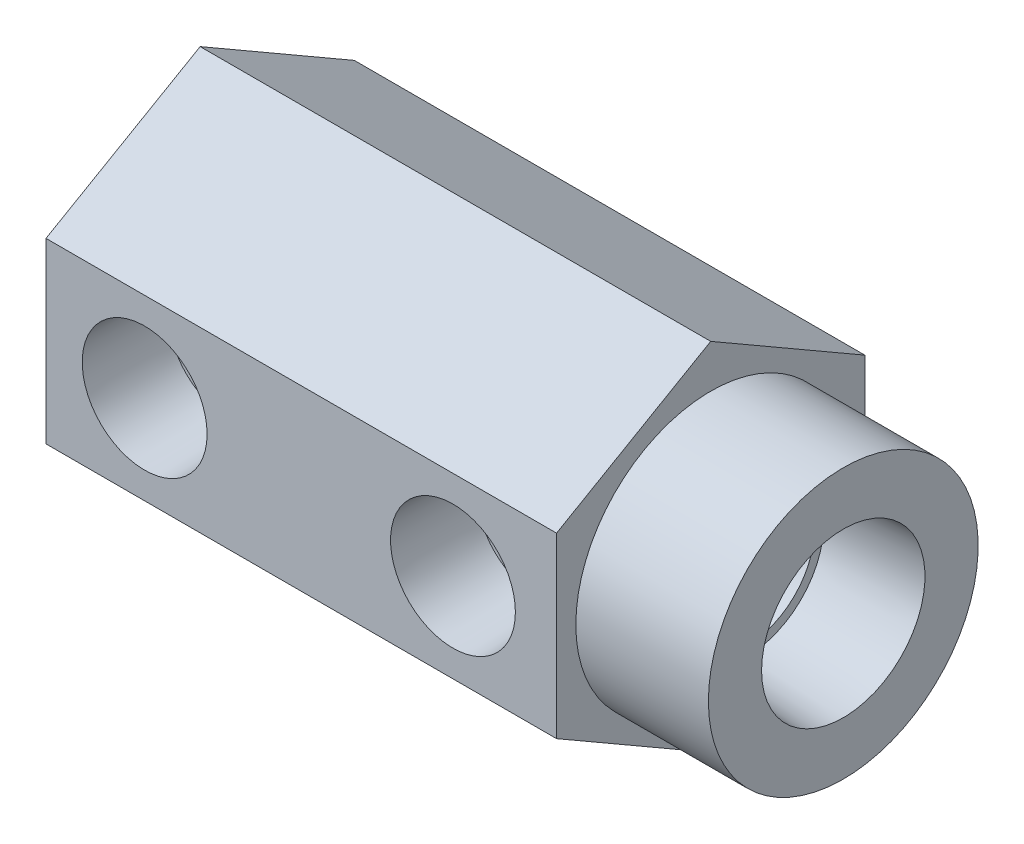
SolidWorks part; units mm, degrees
ref_plane "Front Plane" through (0, 0, 0) normal (0, 0, 1) x (1, 0, 0)
ref_plane "Top Plane" through (0, 0, 0) normal (0, 1, 0) x (1, 0, 0)
ref_plane "Right Plane" through (0, 0, 0) normal (1, 0, 0) x (0, 0, -1)
sketch "Sketch1" plane through (0, 0, 0) normal (1, 0, 0) x (0, 0, -1)
  line L0 (0, 16.1312) -> (0, -16.1312) construction
  line L1 (0, -14.6647) -> (12.7, -7.3323)
  line L2 (12.7, -7.3323) -> (12.7, 7.3323)
  line L3 (12.7, 7.3323) -> (0, 14.6647)
  line L4 (0, 14.6647) -> (-12.7, 7.3323)
  line L5 (-12.7, 7.3323) -> (-12.7, -7.3323)
  line L6 (-12.7, -7.3323) -> (0, -14.6647)
  circle A0 centre (0, 0) radius 12.7 construction
  dimension "D1" = 25.4
extrude "Boss-Extrude1" add sketch "Sketch1" along normal blind 42.0624 separate body
sketch "Sketch2" plane through (0, 0, 0) normal (1, 0, 0) x (0, 0, -1)
  circle A1 centre (0, 0) radius 11.1125
  dimension "D1" = 22.225
extrude "Boss-Extrude2" add sketch "Sketch2" along normal blind 52.9844
hole_wizard "5/16-24 Tapped Hole1" positions "Sketch4" profile "Sketch3" tap size "5/16-24" standard "ANSI Inch"
sketch "Sketch4" plane through (52.9844, 0, 0) normal (1, 0, 0) x (0, 0, -1)
  point P0 (0, 0)
sketch "Sketch3" plane through (52.9844, 0, 0) normal (0, 1, 0) x (0, 0, -1)
  line L0 (0, 0) -> (0, 43.3532)
  line L1 (0, 43.3532) -> (3.4544, 41.2775)
  line L2 (3.4544, 41.2775) -> (3.4544, 36.576)
  line L3 (3.4544, 36.576) -> (3.9687, 36.576)
  line L4 (3.9687, 36.576) -> (3.9688, 0)
  line L5 (3.9688, 0) -> (0, 0)
  line L10 (0, 43.3532) -> (-3.4544, 41.2775) construction
  line L11 (0, -6.35) -> (0, 107.95) construction
  dimension "Tap Drill Dia." = 6.9088
  dimension "Tap Drill Depth" = 41.2775
  dimension "Thread Major Dia." = 7.9375
  dimension "Thread Depth" = 36.576
  dimension "Drill Angle" = 118
hole_wizard "7/32 (0.21875) Diameter Hole1" positions "Sketch6" profile "Sketch5" hole size "7/32" standard "Ansi Inch"
sketch "Sketch6" plane through (52.9844, 0, 0) normal (1, 0, 0) x (0, 0, -1)
  point P0 (0, 0)
sketch "Sketch5" plane through (52.9844, 0, 0) normal (0, 1, 0) x (0, 0, -1)
  line L0 (0, 0) -> (0, 46.1193)
  line L1 (0, 46.1193) -> (2.7781, 44.45)
  line L2 (2.7781, 44.45) -> (2.7781, 0)
  line L5 (2.7781, 0) -> (0, 0)
  line L10 (0, 46.1193) -> (-2.7781, 44.45) construction
  line L11 (0, -6.35) -> (0, 107.95) construction
  dimension "Hole Dia." = 5.5562
  dimension "Hole Depth" = 44.45
  dimension "Drill Angle" = 118
hole_wizard "1/8 NPT Tapped Hole1" positions "Sketch8" profile "Sketch7" size "1/8" standard "Ansi Inch"
sketch "Sketch8" plane through (0, 0, 12.7) normal (0, 0, 1) x (1, 0, 0)
  line L0 (13.97, 0) -> (-13.97, 0) construction
  line L1 (0, -13.97) -> (0, 13.97) construction
  point P0 (8.128, 0)
  point P1 (33.528, 0)
  dimension "D1" = 8.128
  dimension "D2" = 25.4
sketch "Sketch7" plane through (8.128, 0, 12.7) normal (1, 0, 0) x (0, -1, 0)
  line L0 (0, 0) -> (0, 21.5835)
  line L1 (4.2164, 19.05) -> (0, 21.5835)
  line L2 (-4.2164, 19.05) -> (0, 21.5835) construction
  line L3 (4.2164, 19.05) -> (4.2164, 6.924)
  line L4 (4.2164, 6.924) -> (4.9362, 6.924)
  line L5 (4.9362, 6.924) -> (5.1435, 0)
  line L6 (-4.9362, 6.924) -> (-5.1435, 0) construction
  line L7 (5.1435, 0) -> (0, 0)
  line L8 (0, -6.35) -> (0, 107.95) construction
  line L11 (-4.2164, 6.924) -> (-4.9362, 6.924) construction
  dimension "Tap Drill Dia." = 8.4328
  dimension "Tap Drill Depth" = 19.05
  dimension "Thread Dia." = 10.287
  dimension "Thread Angle" = 3.43
  dimension "Thread Depth" = 6.924
  dimension "Drill Angle" = 118
hole_wizard "1/8 NPT Tapped Hole2" positions "Sketch10" profile "Sketch9" size "1/8" standard "Ansi Inch"
sketch "Sketch10" plane through (0, 0, -12.7) normal (0, 0, -1) x (-1, 0, 0)
  line L0 (13.97, 0) -> (-13.97, 0) construction
  line L1 (0, 13.97) -> (0, -13.97) construction
  point P0 (-8.128, 0)
  dimension "D1" = 8.128
sketch "Sketch9" plane through (8.128, 0, -12.7) normal (1, 0, 0) x (0, 1, 0)
  line L0 (0, 0) -> (0, 18.4085)
  line L1 (4.2164, 15.875) -> (0, 18.4085)
  line L2 (-4.2164, 15.875) -> (0, 18.4085) construction
  line L3 (4.2164, 15.875) -> (4.2164, 6.924)
  line L4 (4.2164, 6.924) -> (4.9362, 6.924)
  line L5 (4.9362, 6.924) -> (5.1435, 0)
  line L6 (-4.9362, 6.924) -> (-5.1435, 0) construction
  line L7 (5.1435, 0) -> (0, 0)
  line L8 (0, -6.35) -> (0, 107.95) construction
  line L11 (-4.2164, 6.924) -> (-4.9362, 6.924) construction
  dimension "Tap Drill Dia." = 8.4328
  dimension "Tap Drill Depth" = 15.875
  dimension "Thread Dia." = 10.287
  dimension "Thread Angle" = 3.43
  dimension "Thread Depth" = 6.924
  dimension "Drill Angle" = 118
sketch "Sketch11" plane through (0, 0, 0) normal (0, 1, 0) x (1, 0, 0)
  line L0 (52.9844, -11.1125) -> (52.9844, 11.1125) construction
  line L1 (52.9844, 0) -> (52.9844, 6.731)
  line L5 (52.9844, 6.731) -> (45.0596, 6.3157)
  line L6 (45.0596, 5.5499) -> (45.0596, 6.3157)
  line L7 (45.0596, 5.5499) -> (27.5844, 5.5499)
  line L8 (0, 0) -> (50000, 0) construction
  line L10 (27.5844, 0) -> (27.5844, 5.5499)
  line L11 (27.5844, 0) -> (52.9844, 0)
  dimension "D1" = 25.4
  dimension "D2" = 11.0998
  dimension "D3" = 13.462
  dimension "D4" = 3
  dimension "D5" = 7.9248
revolve "Cut-Revolve1" cut sketch "Sketch11" angle 360 about L8
